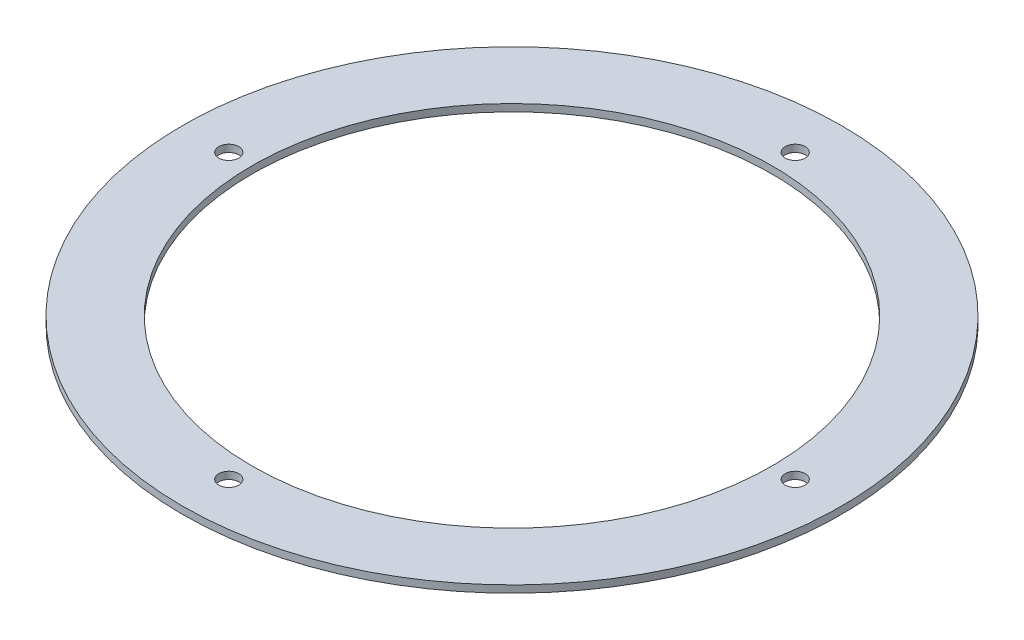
SolidWorks part; units mm, degrees
ref_plane "Front Plane" through (0, 0, 0) normal (0, 0, 1) x (1, 0, 0)
ref_plane "Top Plane" through (0, 0, 0) normal (0, 1, 0) x (1, 0, 0)
ref_plane "Right Plane" through (0, 0, 0) normal (1, 0, 0) x (0, 0, -1)
sketch "Sketch1" plane through (0, 0, 0) normal (0, 1, 0) x (1, 0, 0)
  circle A0 centre (0, 0) radius 81.28
  circle A1 centre (0, 0) radius 64.135
  dimension "D1" = 162.56
  dimension "D2" = 128.27
extrude "Boss-Extrude1" add sketch "Sketch1" along normal blind 1.778 contours A1
sketch "Sketch2" plane through (0, 1.778, 0) normal (0, 1, 0) x (1, 0, 0)
  line L0 (0, 69.85) -> (0, 0) construction
  line L1 (69.85, 0) -> (0, 0) construction
  line L2 (0, -69.85) -> (0, 0) construction
  line L3 (-69.85, 0) -> (0, 0) construction
  circle A0 centre (0, 0) radius 69.85 construction
  point P10 (0, 0)
  dimension "D1" = 69.85
  dimension "D2" = 4
hole_wizard "#10 (0.1935) Diameter Hole1" positions "Sketch5" profile "Sketch6" hole size "#10" standard "ANSI Inch"
sketch "Sketch5" plane through (0, 1.778, 0) normal (0, 1, 0) x (1, 0, 0)
  point P0 (-69.85, 0)
  point P3 (0, -69.85)
  point P6 (69.85, 0)
  point P9 (0, 69.85)
sketch "Sketch6" plane through (-69.85, 1.778, 0) normal (1, 0, 0) x (0, 0, 1)
  line L0 (0, 0) -> (0, 1.778)
  line L1 (0, 1.778) -> (2.4574, 1.778)
  line L2 (2.4574, 1.778) -> (2.4574, 0)
  line L5 (2.4574, 0) -> (0, 0)
  line L11 (0, -6.35) -> (0, 107.95) construction
  dimension "Thru Hole Dia." = 4.9149
  dimension "Thru Hole Depth" = 1.778
